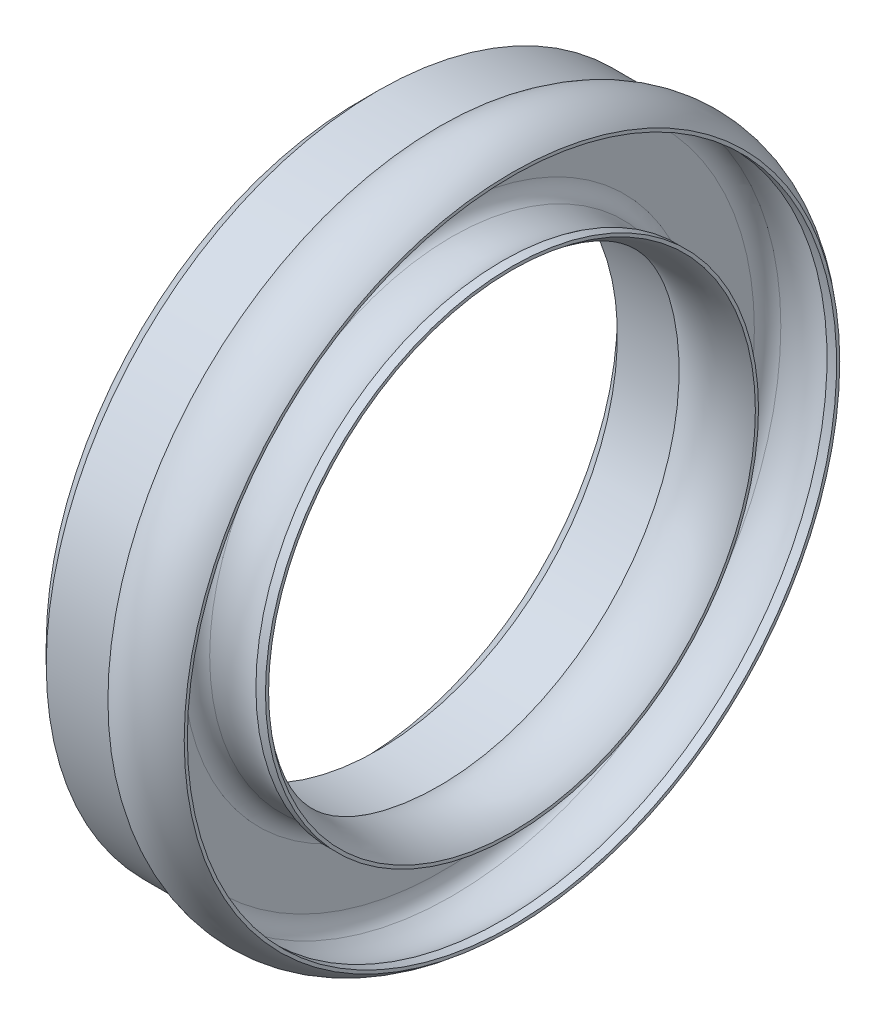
SolidWorks part; units mm, degrees
ref_plane "Plane1" through (0, 0, 0) normal (0, 0, 1) x (1, 0, 0)
ref_plane "Plane2" through (0, 0, 0) normal (0, 1, 0) x (1, 0, 0)
ref_plane "Plane3" through (0, 0, 0) normal (1, 0, 0) x (0, 0, -1)
sketch "Sketch1" plane through (0, 0, 0) normal (0, 0, 1) x (1, 0, 0)
  line L0 (0, 0) -> (8.7334, 0) construction
  line L1 (0, 6.6675) -> (0, 9.2075)
  line L2 (0, 9.2075) -> (2.2225, 9.2075)
  line L3 (0, 6.6675) -> (2.2225, 6.6675)
  line L4 (4.2451, 6.8519) -> (4.2451, 6.7649)
  line L6 (4.2451, 9.0231) -> (3.9791, 9.0231)
  line L7 (4.2451, 6.8519) -> (3.9791, 6.8519)
  line L8 (2.2904, 8.6916) -> (2.2904, 7.1834)
  line L9 (4.2451, 9.1101) -> (4.2451, 9.0231)
  arc A0 (4.2451, 9.1101) -> (2.2225, 9.2075) centre (3.175, 7.9375) ccw
  arc A1 (3.9791, 9.0231) -> (2.5715, 9.1461) centre (3.175, 7.9375) ccw
  arc A2 (2.5715, 6.7289) -> (3.9791, 6.8519) centre (3.175, 7.9375) ccw
  arc A3 (2.2225, 6.6675) -> (4.2451, 6.7649) centre (3.175, 7.9375) ccw
  arc A4 (2.5715, 9.1461) -> (2.2904, 8.6916) centre (2.7984, 8.6916) ccw
  arc A5 (2.5715, 6.7289) -> (2.2904, 7.1834) centre (2.7984, 7.1834) cw
  point P18 (2.2904, 6.9164)
  dimension "D1" = 3.175
  dimension "D3" = 7.9375
  dimension "D4" = 1.27
  dimension "D5" = 1.27
  dimension "D6" = 0.508
  dimension "D2" = 3.175
revolve "Base-Revolve" add sketch "Sketch1" angle 360 about L0
chamfer "Chamfer1" distance 0.508 angle 45
